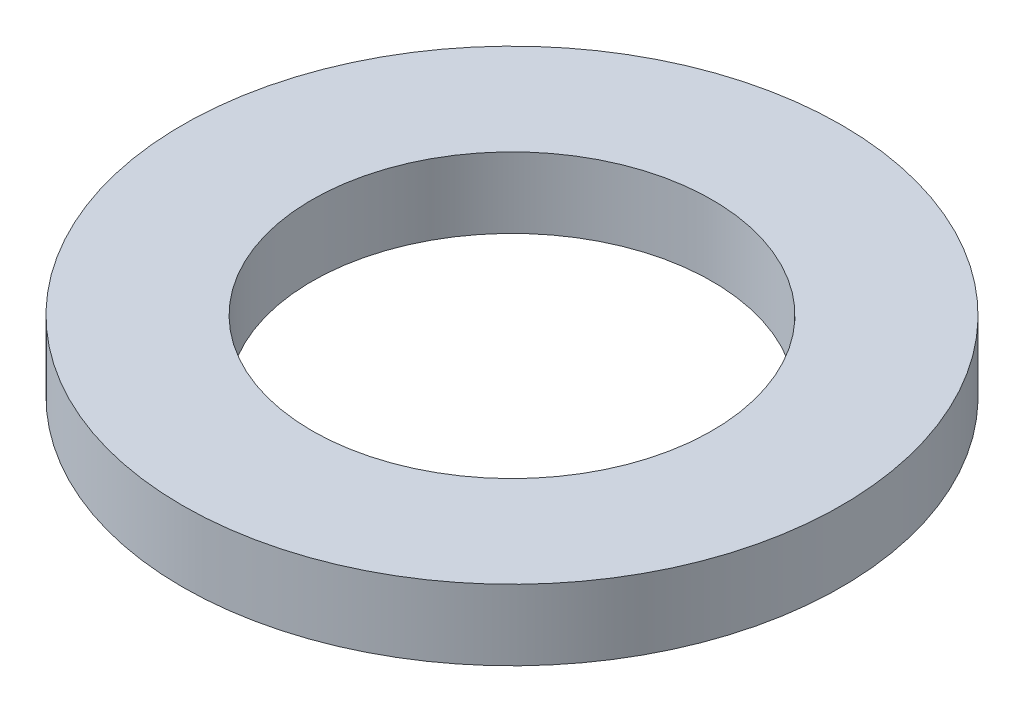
SolidWorks part; units mm, degrees
ref_plane "Piano frontale" through (0, 0, 0) normal (0, 0, 1) x (1, 0, 0)
ref_plane "Piano superiore" through (0, 0, 0) normal (0, 1, 0) x (1, 0, 0)
ref_plane "Piano destro" through (0, 0, 0) normal (1, 0, 0) x (0, 0, -1)
sketch "Schizzo1" plane through (0, 0, 0) normal (0, 1, 0) x (1, 0, 0)
  circle A0 centre (0, 0) radius 7
  circle A1 centre (0, 0) radius 4.25
  dimension "D1" = 14
  dimension "D2" = 8.5
extrude "Estrusione-Estrusione1" add sketch "Schizzo1" along normal blind 1.5
